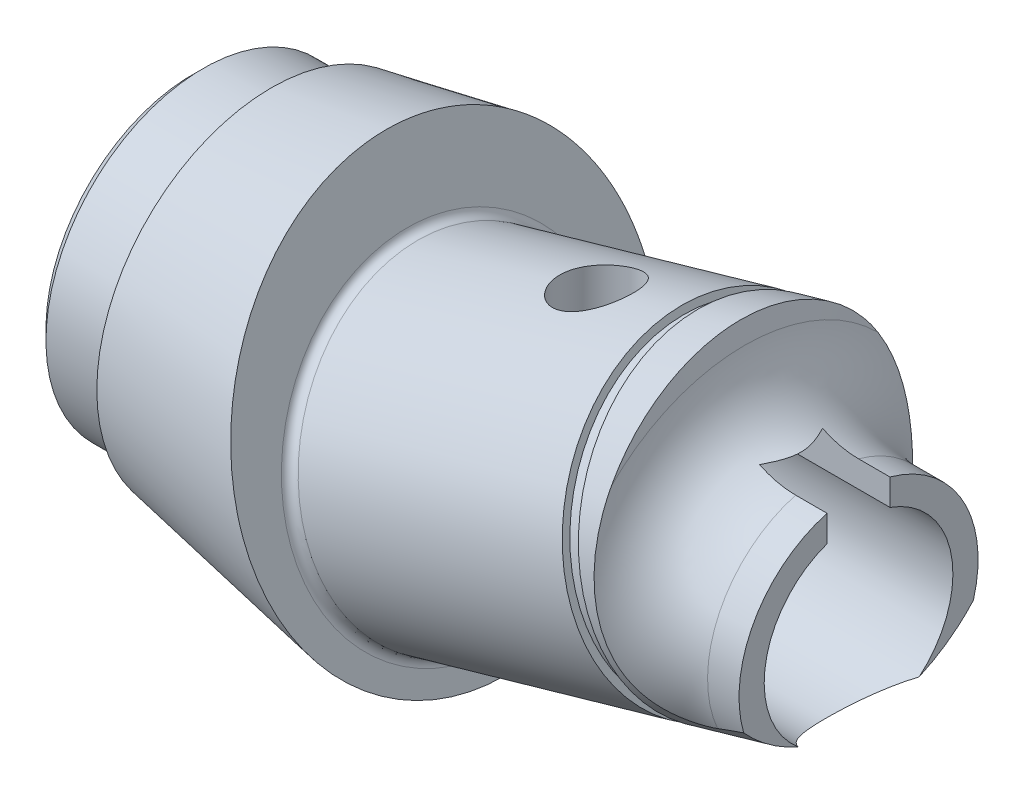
SolidWorks part; units mm, degrees
ref_plane "Face" through (0, 0, 0) normal (0, 0, 1) x (1, 0, 0)
ref_plane "Dessus" through (0, 0, 0) normal (0, 1, 0) x (1, 0, 0)
ref_plane "Droite" through (0, 0, 0) normal (1, 0, 0) x (0, 0, -1)
sketch "Esquisse1" plane through (0, 0, 0) normal (0, 0, 1) x (1, 0, 0)
  line L0 (101.9649, 0) -> (-15.8587, 0) construction
  line L1 (0, 0) -> (0, 15)
  line L6 (0, 15) -> (7.5, 15)
  line L7 (7.5, 15) -> (7.5, 16.65)
  line L8 (63.5, 11.4) -> (60.5, 11.4)
  line L9 (63.5, 11.4) -> (63.5, 0)
  line L10 (7.5, 16.65) -> (51.3666, 24.7802)
  line L11 (63.5, 0) -> (0, 0)
  line L12 (52.634, 17.9421) -> (51.3666, 24.7802)
  arc A0 (52.634, 17.9421) -> (60.5, 11.4) centre (60.5, 19.4) ccw
  dimension "D10" = 38.8
  dimension "D8" = 8
  dimension "D2" = 56
  dimension "D3" = 7.5
  dimension "D4" = 30
  dimension "D5" = 3
  dimension "D6" = 10.5
  dimension "D7" = 63.5
  dimension "D9" = 22.8
  dimension "D11" = 33.3
revolve "Base-Révolution" add sketch "Esquisse1" angle 360 about L0
sketch "Esquisse3" plane through (0, 0, 0) normal (0, 0, 1) x (1, 0, 0)
  line L0 (103.685, 0) -> (-4.931, 0) construction
  line L1 (101.9649, 0) -> (-15.8587, 0) construction
  line L2 (45.0409, -26.8563) -> (35.2321, 7.3513) construction
  line L3 (63.5, -11.4) -> (63.5, 11.4) construction
  line L4 (54.956, 5.0513) -> (19.724, -5.0513) construction
  line L5 (20.709, 10.8356) -> (46.6631, 18.2778)
  line L6 (20.709, 10.8356) -> (14.645, 31.9834)
  line L7 (14.645, 31.9834) -> (62.7081, 45.7653)
  line L8 (48.2011, 18.7189) -> (48.3941, 18.046)
  line L9 (46.856, 17.605) -> (48.3941, 18.046)
  line L10 (46.6631, 18.2778) -> (46.856, 17.605)
  line L11 (48.2011, 18.7189) -> (68.7721, 24.6175)
  line L12 (68.7721, 24.6175) -> (62.7081, 45.7653)
  line L13 (7.5, 16.65) -> (7.5, -16.65) construction
  point P7 (37.34, 0)
  dimension "D1" = 74
  dimension "D2" = 29.84
  dimension "D3" = 13
  dimension "D4" = 28.6
  dimension "D5" = 30
  dimension "D6" = 28.6
  dimension "D7" = 1.6
  dimension "D8" = 50
  dimension "D9" = 22
  dimension "D10" = 26.16
revolve "Enlèvement de matière-Révolution1" cut sketch "Esquisse3" angle 360 about L4
sketch "Esquisse4" plane through (63.5, 0, 0) normal (1, 0, 0) x (0, 0, -1)
  circle A0 centre (0, 0) radius 9
  arc A1 (10.9533, -3.1599) -> (-10.9533, -3.1599) centre (0, 0) ccw construction
  dimension "D1" = 18
extrude "Enlèv. mat.-Extru.1" cut sketch "Esquisse4" against normal through all
fillet "Congé2" radius 0.8 2 edges at (20.709, 10.8356, 0) (7.5, 15, 0)
chamfer "Chanfrein1" distance 1 angle 45 1 edges at (0, 15, 0)
sketch "Esquisse11" plane through (0, 0, 0) normal (-1, 0, 0) x (0, 0, 1)
  circle A0 centre (0, 0) radius 11
  dimension "D1" = 22
extrude "évidement" cut sketch "Esquisse11" against normal blind 10
sketch "Esquisse13" plane through (0, 0, 0) normal (0, 1, 0) x (1, 0, 0)
  line L0 (110.6478, 0) -> (-6.2741, 0) construction
  line L1 (10, 0) -> (63.5, 0) construction
  line L2 (63.5, -11.4) -> (63.5, 11.4) construction
  circle A0 centre (38.5, 0) radius 3.5
  dimension "D1" = 7
  dimension "D2" = 25
extrude "Enlèv. mat.-Extru.9" cut sketch "Esquisse13" along normal through all
sketch "Esquisse12" plane through (63.5, 0, 0) normal (1, 0, 0) x (0, 0, -1)
  line L0 (0, 0) -> (0, 25.9125) construction
  line L1 (3, 11.8) -> (-3, 11.8)
  line L2 (-3, 11.8) -> (-3, 0)
  line L3 (-3, 0) -> (3, 0)
  line L4 (3, 11.8) -> (3, 0)
  point P8 (0, 11.8)
  dimension "D1" = 11.8
  dimension "D2" = 3
extrude "Enlèv. mat.-Extru.8" cut sketch "Esquisse12" against normal up to next
